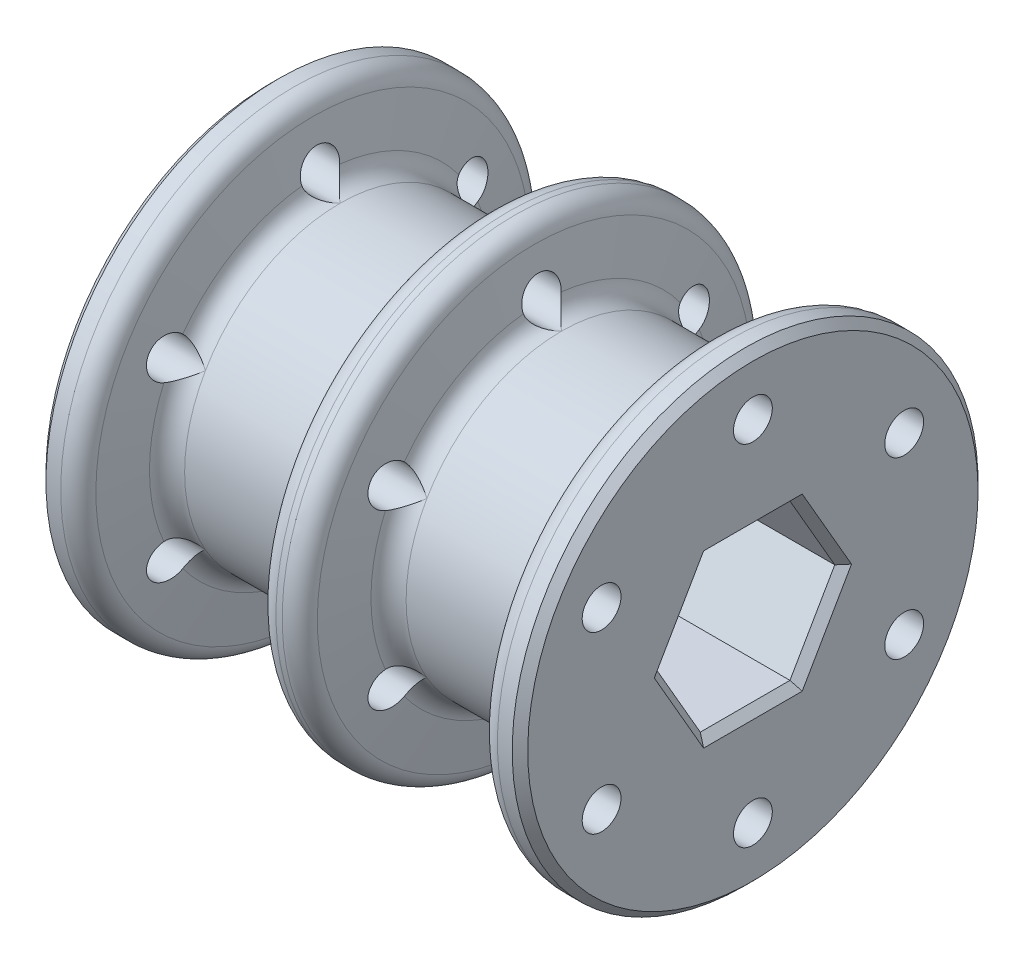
SolidWorks part; units mm, degrees
ref_plane "Front" through (0, 0, 0) normal (0, 0, 1) x (1, 0, 0)
ref_plane "Top" through (0, 0, 0) normal (0, 1, 0) x (1, 0, 0)
ref_plane "Right" through (0, 0, 0) normal (1, 0, 0) x (0, 0, -1)
sketch "Sketch1" plane through (0, 0, 0) normal (0, 0, 1) x (1, 0, 0)
  line L0 (0, 0) -> (0, 19.05)
  line L1 (0, 19.05) -> (3.175, 19.05)
  line L2 (3.175, 19.05) -> (4.2947, 12.7)
  line L3 (4.2947, 12.7) -> (16.9947, 12.7)
  line L4 (16.9947, 12.7) -> (18.1144, 19.05)
  line L5 (18.1144, 19.05) -> (21.2894, 19.05)
  line L6 (21.2894, 19.05) -> (22.409, 12.7)
  line L7 (22.409, 12.7) -> (35.109, 12.7)
  line L8 (35.109, 12.7) -> (36.2287, 19.05)
  line L9 (36.2287, 19.05) -> (39.4037, 19.05)
  line L10 (39.4037, 19.05) -> (39.4037, 0)
  line L11 (39.4037, 0) -> (0, 0)
revolve "Revolve1" add sketch "Sketch1" angle 360 about L11
fillet "Fillet1" radius 1.5875 4 edges at (36.2287, 19.05, 0) (3.175, 19.05, 0) (18.1144, 19.05, 0) (21.2894, 19.05, 0)
chamfer "Chamfer1" distance 0.635 angle 45 2 edges at (0, 19.05, 0) (39.4037, 19.05, 0)
sketch "Sketch2" plane through (0, 0, 0) normal (-1, 0, 0) x (0, 0, 1)
  line L1 (7.3323, 0) -> (3.6662, 6.35)
  line L2 (3.6662, 6.35) -> (-3.6662, 6.35)
  line L3 (-3.6662, 6.35) -> (-7.3323, 0)
  line L4 (-7.3323, 0) -> (-3.6662, -6.35)
  line L5 (-3.6662, -6.35) -> (3.6662, -6.35)
  line L6 (3.6662, -6.35) -> (7.3323, 0)
  circle A0 centre (0, 0) radius 6.35 construction
  dimension "D1" = 12.7
extrude "Cut-Extrude1" cut sketch "Sketch2" against normal through all
sketch "Sketch3" plane through (0, 0, 0) normal (-1, 0, 0) x (0, 0, 1)
  line L0 (0, 0) -> (0, 14.2875) construction
  line L2 (0, 14.2875) -> (-12.3733, 7.1438) construction
  line L3 (-12.3733, 7.1438) -> (-12.3733, -7.1437) construction
  line L4 (-12.3733, -7.1437) -> (0, -14.2875) construction
  line L5 (0, -14.2875) -> (12.3733, -7.1438) construction
  line L6 (12.3733, -7.1438) -> (12.3733, 7.1437) construction
  line L7 (12.3733, 7.1437) -> (0, 14.2875) construction
  circle A0 centre (0, 14.2875) radius 1.5875 construction
  circle A1 centre (0, 0) radius 12.3733 construction
  point P4 (0, 12.7)
  dimension "D1" = 3.175
  dimension "D2" = 12.7
fillet "Fillet2" radius 1.5875 4 edges at (35.109, 12.7, 0) (22.409, 12.7, 0) (16.9947, 12.7, 0) (4.2947, 12.7, 0)
hole_wizard "1/8 (0.125) Diameter Hole1" positions "Sketch4" profile "Sketch6" hole size "1/8" standard "ANSI Inch"
sketch "Sketch4" plane through (0, 0, 0) normal (-1, 0, 0) x (0, 0, 1)
  point P0 (0, 14.2875)
  point P3 (12.3733, 7.1437)
  point P6 (12.3733, -7.1438)
  point P9 (0, -14.2875)
  point P12 (-12.3733, -7.1437)
  point P15 (-12.3733, 7.1438)
sketch "Sketch6" plane through (0, 14.2875, 0) normal (0, 1, 0) x (0, 0, 1)
  line L0 (0, 0) -> (0, 39.4037)
  line L1 (0, 39.4037) -> (1.5875, 39.4037)
  line L2 (1.5875, 39.4037) -> (1.5875, 0)
  line L5 (1.5875, 0) -> (0, 0)
  line L11 (0, -6.35) -> (0, 107.95) construction
  dimension "Thru Hole Dia." = 3.175
  dimension "Thru Hole Depth" = 39.4037
chamfer "Chamfer2" distance 0.635 angle 45 12 edges at (39.4037, 6.35, 0) (39.4037, 3.175, 5.4993) (39.4037, -3.175, 5.4993) (39.4037, -6.35, 0) (39.4037, -3.175, -5.4993) (39.4037, 3.175, -5.4993) (0, -3.175, -5.4993) (0, -6.35, 0) (0, -3.175, 5.4993) (0, 3.175, 5.4993) (0, 6.35, 0) (0, 3.175, -5.4993)
equation "\"D4@Sketch1\"=\"D3@Sketch1\""
